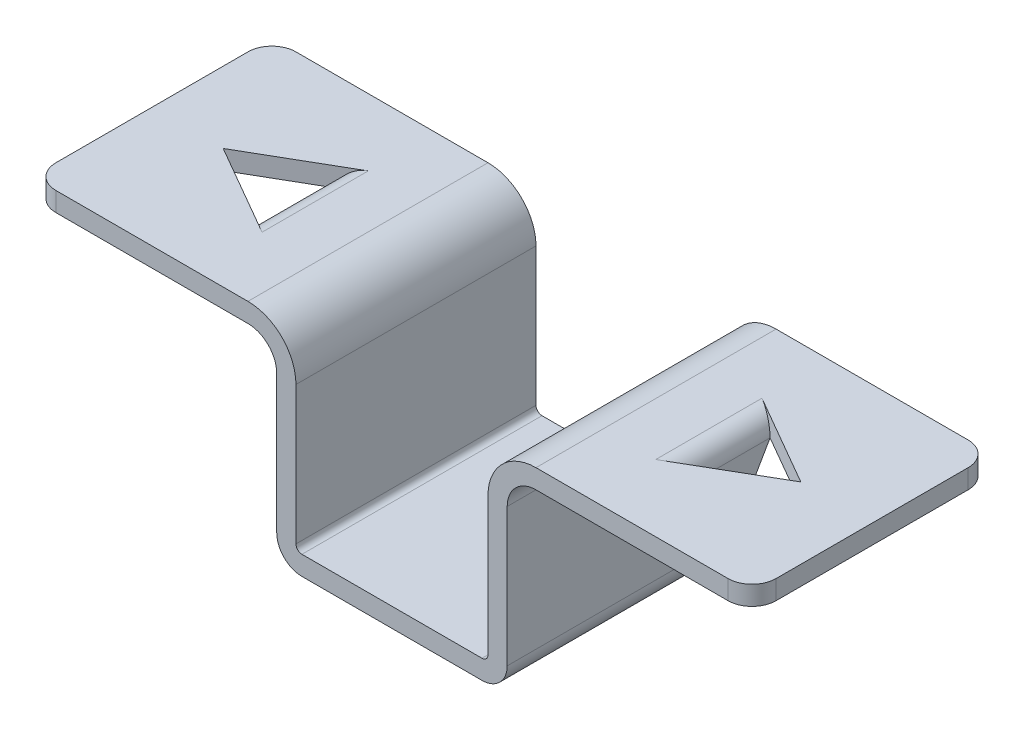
SolidWorks part; units mm, degrees
ref_plane "Plan de face" through (0, 0, 0) normal (0, 0, 1) x (1, 0, 0)
ref_plane "Plan de dessus" through (0, 0, 0) normal (0, 1, 0) x (1, 0, 0)
ref_plane "Plan de droite" through (0, 0, 0) normal (1, 0, 0) x (0, 0, -1)
sketch "Esquisse1" plane through (0, 0, 0) normal (0, 0, 1) x (1, 0, 0)
  line L0 (-15, 0) -> (-6, 0)
  line L1 (-4, -2) -> (-4, -7.75)
  line L2 (-3.75, -8) -> (3.75, -8)
  line L3 (4, -7.75) -> (4, -2)
  line L4 (6, 0) -> (15, 0)
  line L5 (0, 0) -> (0, -8) construction
  line L6 (-15, -0.8) -> (-6, -0.8)
  line L7 (-4.8, -2) -> (-4.8, -7.75)
  line L8 (-3.75, -8.8) -> (3.75, -8.8)
  line L9 (4.8, -7.75) -> (4.8, -2)
  line L10 (6, -0.8) -> (15, -0.8)
  line L11 (-15, 0) -> (-15, -0.8)
  line L12 (15, 0) -> (15, -0.8)
  arc A0 (-6, 0) -> (-4, -2) centre (-6, -2) cw
  arc A1 (4, -2) -> (6, 0) centre (6, -2) cw
  arc A2 (3.75, -8) -> (4, -7.75) centre (3.75, -7.75) ccw
  arc A3 (-4, -7.75) -> (-3.75, -8) centre (-3.75, -7.75) ccw
  arc A4 (-6, -0.8) -> (-4.8, -2) centre (-6, -2) cw
  arc A5 (-4.8, -7.75) -> (-3.75, -8.8) centre (-3.75, -7.75) ccw
  arc A6 (3.75, -8.8) -> (4.8, -7.75) centre (3.75, -7.75) ccw
  arc A7 (4.8, -2) -> (6, -0.8) centre (6, -2) cw
  point P11 (-4, 0)
  point P18 (-4, -8)
  dimension "D4" = 2
  dimension "D5" = 0.25
  dimension "D1" = 30
  dimension "D2" = 8
  dimension "D3" = 8
  dimension "D6" = 0.8
extrude "Boss.-Extru.1" add sketch "Esquisse1" along normal mid plane 10
sketch "Esquisse2" plane through (0, 0, 0) normal (0, 1, 0) x (1, 0, 0)
  line L0 (-15, 0) -> (0, 0) construction
  line L1 (-15, -5) -> (-15, 5) construction
  line L2 (0, 0) -> (0, 5) construction
  line L3 (-9, 1.75) -> (-9, -1.75)
  line L4 (-9, -1.75) -> (-12.0311, 0)
  line L5 (-12.0311, 0) -> (-9, 1.75)
  line L7 (-4, -5) -> (-4, 5) construction
  line L8 (12.0311, 0) -> (9, 1.75)
  line L9 (9, -1.75) -> (12.0311, 0)
  line L10 (9, 1.75) -> (9, -1.75)
  dimension "D1" = 3.5
  dimension "D2" = 5
extrude "Enlèv. mat.-Extru.1" cut sketch "Esquisse2" against normal through all
sketch "Esquisse3" plane through (-9, 0, 0) normal (-1, 0, 0) x (0, 0, 1)
  line L0 (1.75, -0.8) -> (0, -3.8311)
  line L1 (0, -3.8311) -> (-1.75, -0.8)
  line L2 (1.75, -0.8) -> (-1.75, -0.8) construction
  line L3 (1.75, -0.8) -> (-1.75, -0.8)
extrude "Boss.-Extru.2" add sketch "Esquisse3" against normal blind 0.8
mirror "Symétrie2" about plane through (0, 0, 0) normal (1, 0, 0) of "Boss.-Extru.2"
fillet "Congé1" radius 0.8 2 edges at (-9, 0, 0) (9, 0, 0)
fillet "Congé2" radius 1 4 edges at (-15, -0.4, 5) (-15, -0.4, -5) (15, -0.4, 5) (15, -0.4, -5)
sketch "Esquisse4" plane through (0, 0, 0) normal (0, 1, 0) x (1, 0, 0)
  line L0 (12.0311, 0) -> (8.2, 2.2119) construction
  line L3 (8.2, -2.2119) -> (12.0311, 0) construction
  line L4 (9, 1.75) -> (9, -1.75) construction
  line L5 (0, 0) -> (0, 5.2176) construction
  circle A0 centre (10.0104, 0) radius 1.0104 construction
  circle A1 centre (-10.0104, 0) radius 1.0104 construction
  point P8 (10.0104, 0)
